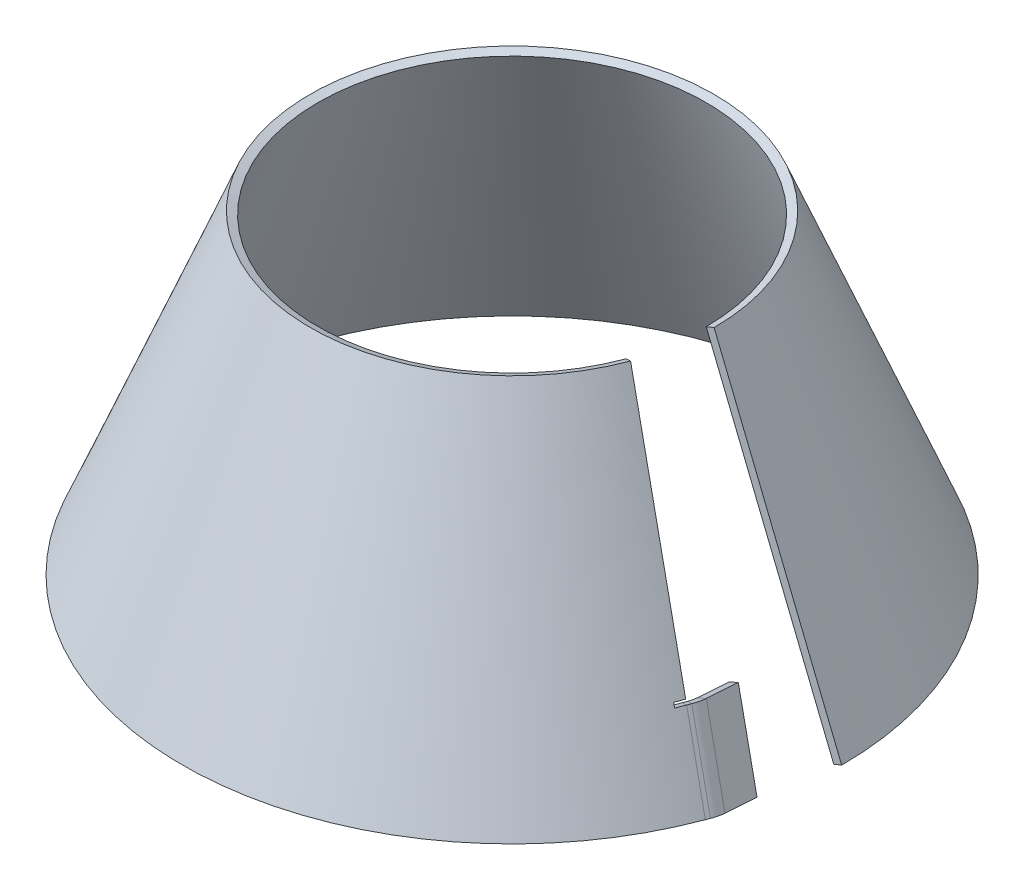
SolidWorks part; units mm, degrees
ref_plane "Vorne" through (0, 0, 0) normal (0, 0, 1) x (1, 0, 0)
ref_plane "Oben" through (0, 0, 0) normal (0, 1, 0) x (1, 0, 0)
ref_plane "Rechts" through (0, 0, 0) normal (1, 0, 0) x (0, 0, -1)
sketch "Skizze1" plane through (0, 0, 0) normal (0, 0, 1) x (1, 0, 0)
  line L0 (37.8037, 0) -> (22.8126, 37.0433)
  line L1 (0, 0) -> (0, 37.0433) construction
revolve "Rotation-Dünn1" add sketch "Skizze1" angle 339.5 about L1
ref_plane "Ebene1" through (35.4097, 0, 13.2391) normal (-0.3514, 0.927, -0.1314) x (-0.9362, -0.3479, 0.0493)
sketch "Skizze2" plane through (35.4097, 0, 13.2391) normal (-0.3514, 0.927, -0.1314) x (-0.9362, -0.3479, 0.0493)
  line L0 (0, 0) -> (-0.9274, 0.3741)
  line L1 (0, 0) -> (-0.3741, -0.9274)
  line L2 (-0.9274, 0.3741) -> (-1.4017, -0.8018)
  line L3 (-1.4017, -0.8018) -> (-0.6655, -6.0181)
  line L4 (-0.9274, 0.3741) -> (0, 0) construction
  line L5 (-0.3741, -0.9274) -> (0.3247, -5.8783)
  line L6 (0.3247, -5.8783) -> (-0.6655, -6.0181)
  dimension "D1" = 30
  dimension "D2" = 1
  dimension "D3" = 0
  dimension "D4" = 1
  dimension "D5" = 5
extrude "Linear austragen1" add sketch "Skizze2" along normal blind 10
sketch "Skizze5" plane through (1.4693, -3.8762, 0.5494) normal (-0.3514, 0.927, -0.1314) x (-0.9362, -0.3479, 0.0493)
  line L0 (-32.6923, 11.6521) -> (-34.79, 13.2494)
  line L1 (-32.6923, 11.6521) -> (-31.4365, 13.3013)
  line L2 (-34.79, 13.2494) -> (-33.5342, 14.8986)
  line L3 (-31.4365, 13.3013) -> (-33.5342, 14.8986)
extrude "Schnitt-Linear austragen1" cut sketch "Skizze5" along normal blind 0.5
sheet metal parameters "Blech2" parameters "D1"=2, "Dicke"=1
bend "Biegung-Rundung1" bend radius 37.8037
flatten bends "Abwickeln2" parameters "D1"=0, "D4"=339.5, "D5"=1
sketch "Skizze-Winkel2" plane through (31.2351, 18.8968, 0) normal (0.927, 0.3751, 0) x (0, 0, -1)
  line L0 (55.6143, 54.5167) -> (91.4332, 36.798) construction
  line L1 (72.47, 138.7277) -> (80.4184, 144.7957) construction
bend "Biegung-Winkel1" bend angle 30 parameters "D1"=0, "D5"=2
process bends "Abbiegen2" parameters "D1"=0
sketch "Abwicklung-Skizze2" plane through (33.4107, 13.521, 0) normal (0.927, 0.3751, 0) x (0, 0, -1)
